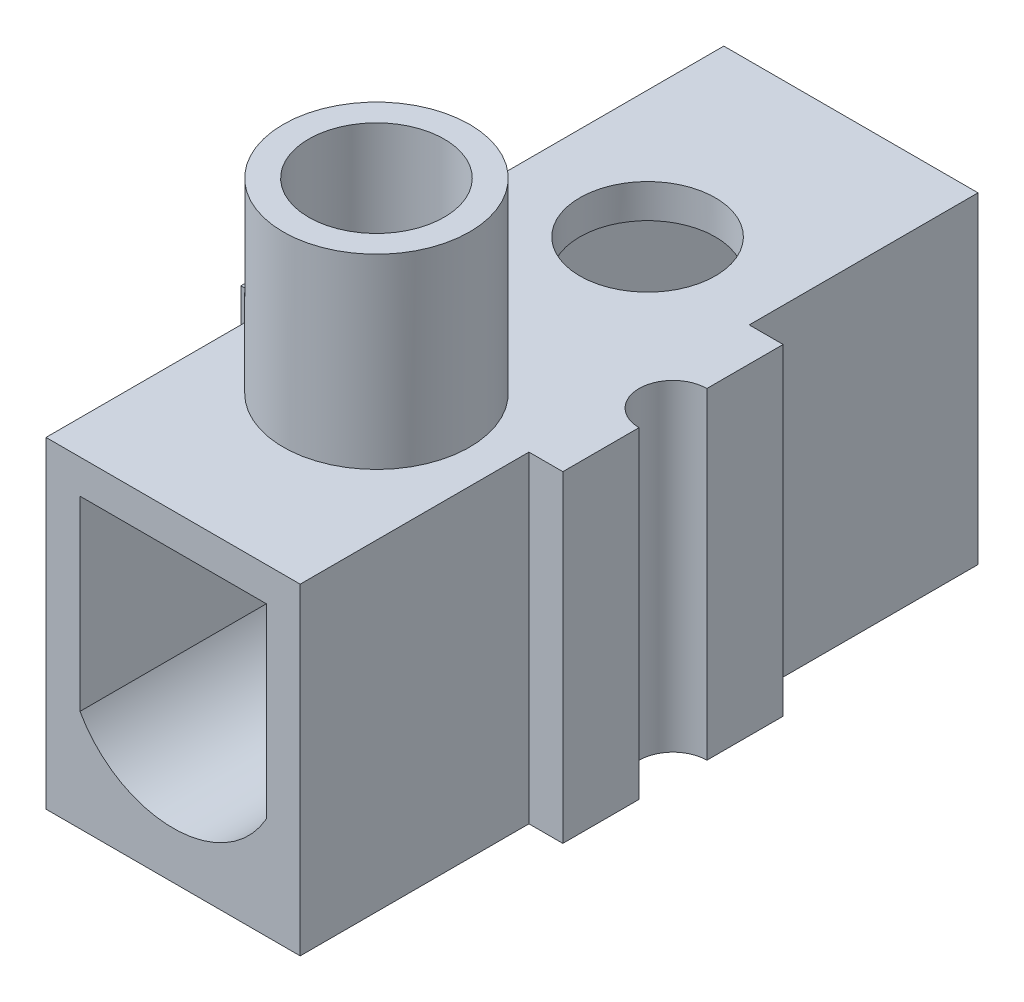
SolidWorks part; units mm, degrees
ref_plane "Plan1" through (0, 0, 0) normal (0, 0, 1) x (1, 0, 0)
ref_plane "Plan2" through (0, 0, 0) normal (0, 1, 0) x (1, 0, 0)
ref_plane "Plan3" through (0, 0, 0) normal (1, 0, 0) x (0, 0, -1)
sketch "Esquisse1" plane through (0, 0, 0) normal (0, 0, 1) x (1, 0, 0)
  line L0 (-2.7474, -1) -> (2.75, -1)
  line L1 (-3.75, 0) -> (3.75, 0)
  line L2 (-3.75, 0) -> (-3.75, -9.5)
  line L3 (-3.75, -9.5) -> (3.75, -9.5)
  line L4 (3.75, 0) -> (3.75, -9.5)
  line L5 (2.75, -1) -> (2.75, -6.5)
  line L6 (-2.7474, -1) -> (-2.7474, -6.5)
  arc A0 (-2.7474, -6.5) -> (2.75, -6.5) centre (0.0013, -4.9615) ccw
  dimension "D8" = 3.15
  dimension "D1" = 7.5
  dimension "D2" = 9.5
  dimension "D3" = 1
  dimension "D4" = 1
  dimension "D5" = 1.0026
  dimension "D6" = 5.5
  dimension "D7" = 5.5
extrude "Extrusion1" add sketch "Esquisse1" along normal mid plane 20
sketch "Esquisse2" plane through (3.75, 0, 0) normal (1, 0, 0) x (0, 0, -1)
  line L0 (-10, 0) -> (10, 0) construction
  line L1 (-3.25, 0) -> (3.25, 0)
  line L2 (-3.25, 0) -> (-3.25, -9.5)
  line L3 (-3.25, -9.5) -> (3.25, -9.5)
  line L4 (3.25, 0) -> (3.25, -9.5)
  line L5 (-10, -9.5) -> (10, -9.5) construction
  dimension "D1" = 6.5
extrude "Extrusion2" add sketch "Esquisse2" along normal blind 1
mirror "Symétrie1" about plane through (0, 0, 0) normal (1, 0, 0) of "Extrusion2"
sketch "Esquisse3" plane through (0, 0, 0) normal (0, 1, 0) x (-1, 0, 0)
  line L0 (-4.75, -3.25) -> (-4.75, 3.25) construction
  line L1 (-4.75, 1) -> (-4.75, -1)
  line L2 (0, -5.2114) -> (0, 4.8181) construction
  line L3 (4.75, 1) -> (4.75, -1)
  arc A0 (-4.75, -1) -> (-4.75, 1) centre (-4.75, 0) ccw
  arc A1 (4.75, -1) -> (4.75, 1) centre (4.75, 0) cw
  dimension "D1" = 1
extrude "Enlèv. mat.-Extru.1" cut sketch "Esquisse3" against normal through all
sketch "Esquisse4" plane through (0, 0, 0) normal (0, 1, 0) x (-1, 0, 0)
  circle A0 centre (0, 4) radius 2
  circle A1 centre (0, -4) radius 2
  dimension "D1" = 4
  dimension "D2" = 4
  dimension "D3" = 4
  dimension "D4" = 4
extrude "Enlèv. mat.-Extru.2" cut sketch "Esquisse4" against normal blind 3
sketch "Esquisse5" plane through (0, 0, 0) normal (0, 1, 0) x (-1, 0, 0)
  circle A0 centre (0, 4) radius 2
  circle A1 centre (0, 4) radius 2 construction
  circle A2 centre (0, 4) radius 2.75
  dimension "D1" = 5.5
extrude "Extrusion3" add sketch "Esquisse5" along normal blind 5.5
sketch "Esquisse6" plane through (0, 0, 0) normal (0, 1, 0) x (-1, 0, 0)
  circle A0 centre (0, -4) radius 2
  ellipse E0 centre (0, -4) end of major axis (0, -9) minor radius 2.75
  dimension "D3" = 4
  dimension "D1" = 5.5
  dimension "D2" = 10
sketch "Esquisse7" plane through (0, 5.5, 0) normal (0, 1, 0) x (-1, 0, 0)
  ellipse E0 centre (0, -4) end of major axis (0, -9) minor radius 2.75
  ellipse E1 centre (0, -4) end of major axis (0, -8.5) minor radius 2.25
  dimension "D1" = 4.5
  dimension "D2" = 9
sketch "Esquisse8" plane through (0, 0, 0) normal (1, 0, 0) x (0, 0, -1)
  line L0 (-0.9862, 5.5) -> (-1, 0)
  line L1 (-1, 0) -> (2, 0)
  line L2 (2, 0) -> (-0.5, 5.5)
  line L3 (-0.5, 5.5) -> (-0.9862, 5.5)
  line L4 (9, 5.5) -> (-1, 5.5) construction
  line L5 (6, 0) -> (2, 0) construction
  line L6 (8.5, 5.5) -> (6, 0)
  line L7 (6, 0) -> (9, 0)
  line L8 (9, 0) -> (9, 5.5)
  line L9 (9, 5.5) -> (8.5, 5.5)
ref_plane "Plan4" through (0, 0, -4) normal (0, 0, 1) x (1, 0, 0)
sketch "Esquisse9" plane through (0, 0, -4) normal (0, 0, 1) x (1, 0, 0)
  line L0 (2.25, 5.5) -> (2.75, 5.5)
  line L1 (2.75, 5.5) -> (2.75, 0)
  line L2 (2.75, 0) -> (1.9465, 0)
  line L3 (1.9465, 0) -> (2.25, 5.5)
  line L4 (-2.25, 5.5) -> (-2.75, 5.5)
  line L5 (-2.75, 5.5) -> (-2.75, 0)
  line L6 (-2.75, 0) -> (-2.0459, 0)
  line L7 (-2.0459, 0) -> (-2.25, 5.5)
